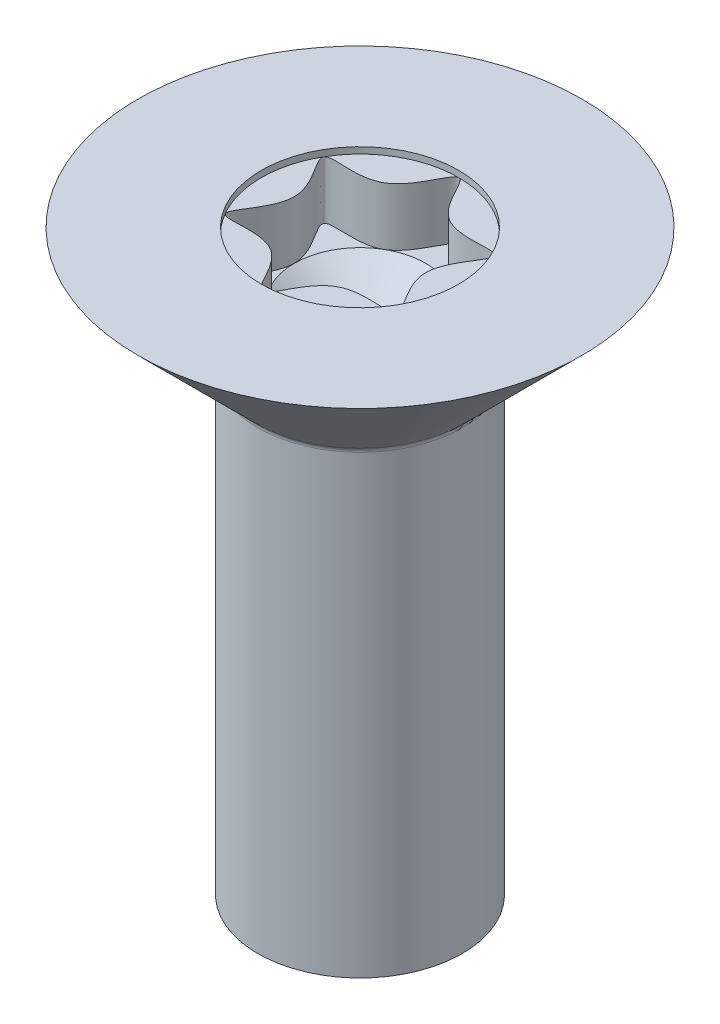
SolidWorks part; units mm, degrees
ref_plane "Front" through (0, 0, 0) normal (0, 0, 1) x (1, 0, 0)
ref_plane "Top" through (0, 0, 0) normal (0, 1, 0) x (1, 0, 0)
ref_plane "Right" through (0, 0, 0) normal (1, 0, 0) x (0, 0, -1)
sketch "Sketch1" plane through (0, 0, 0) normal (0, 0, 1) x (1, 0, 0)
  line L0 (0, 0) -> (0, 8.8882) construction
  line L1 (0, 8.2) -> (3.15, 8.2)
  line L2 (1.45, 0) -> (1.45, 6.5)
  line L3 (1.45, 6.5) -> (2.55, 6.5) construction
  line L4 (2.55, 6.5) -> (2.55, 5.4) construction
  line L5 (1.45, 0) -> (0, 0)
  line L6 (0, 0) -> (0, 8.2)
  line L7 (3.15, 8.2) -> (1.45, 6.5)
revolve "Body-Revolve" add sketch "Sketch1" angle 360 about L0
sketch "Sketch2" plane through (0, 8.2, 0) normal (0, 1, 0) x (-1, 0, 0)
  line L0 (0, 0) -> (0, -1.54)
  line L1 (0, 0) -> (-0.7, -1.2124)
  circle A0 centre (0, 0) radius 1.4
  circle A1 centre (0, 0) radius 0.9333
  spline S0 degree 3 poles (0.302, -0.523) (0, -1.8385) (-0.302, -0.523) (-1.5922, -0.9193) (-0.6039, 0) (-1.5922, 0.9193) (-0.302, 0.523) (0, 1.8385) (0.302, 0.523) (1.5922, 0.9193) (0.6039, 0) (1.5922, -0.9193) (0.302, -0.523) (0, -1.8385) (-0.302, -0.523) knots -0.25 -0.166667 -0.083333 0 0.083333 0.166667 0.25 0.333333 0.416667 0.5 0.583333 0.666667 0.75 0.833333 0.916667 1 1.083333 1.166667 1.25 only from (0, -1.4) to (0, -1.4)
  point P4 (0, -1.4)
  point P7 (-0.4667, -0.8083)
  point P10 (-1.2124, -0.7)
  point P11 (-1.2124, 0.7)
  point P12 (0, 1.4)
  point P13 (1.2124, 0.7)
  point P14 (1.2124, -0.7)
  point P15 (-0.9333, 0)
  point P16 (-0.4667, 0.8083)
  point P17 (0.4667, 0.8083)
  point P18 (0.9333, 0)
  point P19 (0.4667, -0.8083)
extrude "Recess-Cut-Extrude1" cut sketch "Sketch2" against normal blind 0.91 contours S0
sketch "Sketch3" plane through (0, 8.2, 0) normal (0, 1, 0) x (-1, 0, 0)
  circle A0 centre (0, 0) radius 1.4
extrude "Recess-Cut-Extrude2" cut sketch "Sketch3" against normal blind 0.091
sketch "Sketch4" plane through (0, 0, 0) normal (0, 0, 1) x (1, 0, 0)
  line L0 (0, 7.29) -> (0.9333, 7.29)
  line L1 (1.2177, 7.29) -> (-1.2177, 7.29) construction
  line L2 (0.9333, 7.29) -> (0, 6.67)
  line L3 (0, 0) -> (0, 8.8882) construction
  line L4 (0, 6.67) -> (0, 7.29)
  line L5 (1.4, 8.2) -> (-1.4, 8.2) construction
revolve "Drill-Cut-Revolve" cut sketch "Sketch4" angle 360 about axis through (0, 0, 0) along (0, 1, 0)
fillet "Fillet1" radius 0.1 1 edges at (0, 6.5, -1.45)
sketch "Sketch5" plane through (0, 0, 0) normal (0, 0, 1) x (1, 0, 0)
  line L0 (1.45, 5.4) -> (1.45, 4.7125)
  line L1 (1.45, 0) -> (1.45, 6.4586) construction
  line L2 (1.45, 4.7125) -> (0.8546, 5.0563)
  line L3 (0.8546, 5.0563) -> (1.45, 5.4)
  line L4 (0, 0) -> (0, 8.8882) construction
  line L5 (-1.45, 0) -> (1.45, 0) construction
revolve "ThreadSchematic" [suppressed] cut sketch "Sketch5" angle 360 about axis through (0, 0, 0) along (0, 1, 0)
pattern_linear "ThdSchPat" [suppressed] count 5 spacing 1.1 along (0, 1, 0)
sketch "Sketch6" plane through (0, 0, 0) normal (0, 0, 1) x (1, 0, 0)
  line L0 (0.01, 0) -> (1.45, 0)
  line L1 (-1.45, 0) -> (1.45, 0) construction
  line L2 (1.45, 0) -> (1.45, 2.6)
  line L4 (1.45, 2.6) -> (0.01, 0)
  line L5 (0, 0) -> (0, 8.8882) construction
revolve "TypeC" [suppressed] cut sketch "Sketch6" angle 360 about axis through (0, 0, 0) along (0, 1, 0)
sketch "Sketch7" plane through (0, 0, 0) normal (0, 0, 1) x (1, 0, 0)
  line L0 (1.2293, 0) -> (1.45, 0)
  line L1 (0, 0) -> (0, 8.8882) construction
  line L2 (1.45, 0) -> (1.45, 2.1)
  line L4 (1.45, 2.1) -> (1.2293, 0)
  line L5 (-1.45, 0) -> (1.45, 0) construction
revolve "TypeF" [suppressed] cut sketch "Sketch7" angle 360 about axis through (0, 0, 0) along (0, 1, 0)
sketch "Sketch8" plane through (0, 0, 0) normal (0, 0, 1) x (1, 0, 0)
  line L0 (1.45, -0.09) -> (1.45, 2)
  line L2 (1.45, 2) -> (0.1163, 0.0456)
  line L3 (0.03, 0) -> (0.03, -0.09)
  line L4 (0.03, -0.09) -> (1.45, -0.09)
  line L5 (0, 0) -> (0, 8.8882) construction
  line L9 (-1.45, 0) -> (1.45, 0) construction
  arc A0 (0.1163, 0.0456) -> (0.03, 0) centre (0.03, 0.1045) cw
revolve "TypeR" [suppressed] cut sketch "Sketch8" angle 360 about axis through (0, 0, 0) along (0, 1, 0)
equation "\"thread_gap@Sketch1\" = \"pitch@Sketch1\""
equation "\"D1@ThreadCosmetic\" = \"length@Sketch1\" - \"head_ht@Sketch1\" - \"thread_gap@Sketch1\""
equation "\"D2@ThreadCosmetic\" = \"head_dia@Sketch1\" - \"head_ht@Sketch1\" * 2 - 1.0825 * \"pitch@Sketch1\""
equation "\"D1@Sketch2\" = \"socket_dia@Sketch2\" / 1.5"
equation "\"D3@Sketch2\" = \"socket_dia@Sketch2\" / 2 * 1.1"
equation "\"D1@Sketch3\" = \"socket_dia@Sketch2\""
equation "\"D1@Recess-Cut-Extrude2\" = 0.1 * \"socket-dep@Recess-Cut-Extrude1\""
equation "\"D1@Sketch4\" = 0.9*\"head_ht@Sketch1\""
equation "\"D2@Sketch4\" = \"D1@Sketch2\" / 2"
equation "\"D1@Sketch5\" = \"D2@ThreadCosmetic\" / 2"
equation "\"D2@Sketch5\" = \"D1@ThreadCosmetic\""
equation "\"D3@ThdSchPat\" = \"pitch@Sketch1\""
equation "\"D1@ThdSchPat\" = \"D1@ThreadCosmetic\" / \"D3@ThdSchPat\""
equation "\"D1@Sketch6\" = \"head_dia@Sketch1\" / 2 - \"head_ht@Sketch1\""
equation "\"D2@Sketch7\" = \"head_dia@Sketch1\" / 2 - \"head_ht@Sketch1\""
equation "\"D3@Sketch8\" = \"head_dia@Sketch1\" * 0.5 - \"head_ht@Sketch1\""
equation "\"D4@Sketch8\" = \"end_lengthR@Sketch8\" / 20"
